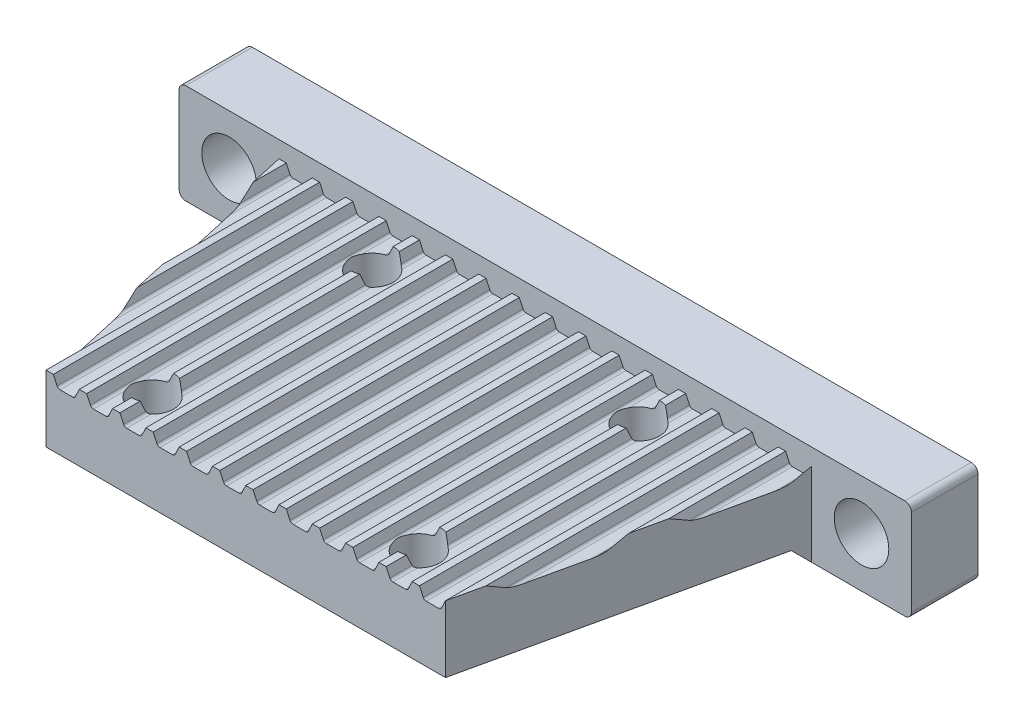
SolidWorks part; units mm, degrees
ref_plane "Plan de face" through (0, 0, 0) normal (0, 0, 1) x (1, 0, 0)
ref_plane "Plan de dessus" through (0, 0, 0) normal (0, 1, 0) x (1, 0, 0)
ref_plane "Plan de droite" through (0, 0, 0) normal (1, 0, 0) x (0, 0, -1)
sketch "Esquisse1" plane through (0, 0, 0) normal (0, 0, 1) x (1, 0, 0)
  line L1 (0, 0) -> (110, 0)
  line L2 (0, 0) -> (0, -15)
  line L3 (0, -15) -> (110, -15)
  line L4 (110, 0) -> (110, -15)
  dimension "D1" = 15
  dimension "D2" = 110
extrude "Boss.-Extru.1" add sketch "Esquisse1" along normal blind 10
sketch "Esquisse2" plane through (0, 0, 10) normal (0, 0, 1) x (1, 0, 0)
  line L1 (15, -2.5) -> (95, -2.5)
  line L2 (15, -2.5) -> (15, -12.5)
  line L3 (15, -12.5) -> (95, -12.5)
  line L4 (95, -2.5) -> (95, -12.5)
  line L5 (110, -15) -> (110, 0) construction
  line L6 (0, 0) -> (0, -15) construction
  point P8 (0, -7.5)
  point P9 (15, -7.5)
  dimension "D1" = 10
  dimension "D2" = 80
  dimension "D3" = 15
extrude "Boss.-Extru.2" add sketch "Esquisse2" along normal blind 45
sketch "Esquisse3" plane through (0, 0, 55) normal (0, 0, 1) x (1, 0, 0)
  line L0 (21.1011, -2.5) -> (20, -2.5) construction
  line L1 (16.1011, -2.5) -> (20, -2.5)
  line L6 (20, -2.5) -> (19.4352, -3.7113)
  line L7 (18.982, -4) -> (17.1191, -4)
  line L8 (16.6659, -3.7113) -> (16.1011, -2.5)
  line L9 (16.1011, -2.5) -> (15, -2.5) construction
  arc A0 (19.4352, -3.7113) -> (18.982, -4) centre (18.982, -3.5) cw
  arc A1 (17.1191, -4) -> (16.6659, -3.7113) centre (17.1191, -3.5) cw
  dimension "D5" = 0.5
  dimension "D6" = 0.5
  dimension "D1" = 1.8629
  dimension "D2" = 115
  dimension "D3" = 115
  dimension "D4" = 1.5
  dimension "D7" = 3.8989
  dimension "D8" = 1.1011
  dimension "D9" = 1.1011
extrude "Enlèv. mat.-Extru.1" cut sketch "Esquisse3" against normal blind 45
pattern_linear "Répétition linéaire1" count 19 spacing 5 along (1, 0, 0) of "Enlèv. mat.-Extru.1"
sketch "Esquisse5" plane through (0, -12.5, 0) normal (0, -1, 0) x (-1, 0, 0)
  line L0 (-85, -55) -> (-95, -10)
  line L2 (-95, -10) -> (-95, -55)
  line L3 (-95, -55) -> (-85, -55)
  line L4 (-15, -55) -> (-15, -10)
  line L5 (-15, -10) -> (-25, -55)
  line L6 (-25, -55) -> (-15, -55)
  dimension "D1" = 10
  dimension "D2" = 10
extrude "Enlèv. mat.-Extru.2" cut sketch "Esquisse5" against normal blind 45
sketch "Esquisse6" plane through (0, -12.5, 0) normal (0, -1, 0) x (1, 0, 0)
  line L1 (35, 16) -> (75, 16) construction
  line L2 (35, 16) -> (35, 49) construction
  line L3 (35, 49) -> (75, 49) construction
  line L4 (75, 16) -> (75, 49) construction
  line L6 (25, 55) -> (85, 55) construction
  circle A0 centre (35, 16) radius 3.15
  circle A1 centre (35, 49) radius 3.15
  circle A2 centre (75, 16) radius 3.15
  circle A3 centre (75, 49) radius 3.15
  point P7 (55, 49)
  point P18 (55, 55)
  dimension "D3" = 6.3
  dimension "D4" = 6
  dimension "D1" = 33
  dimension "D2" = 40
extrude "Enlèv. mat.-Extru.3" cut sketch "Esquisse6" against normal through all
chamfer "Chanfrein1" distance 2.5 angle 45 1 edges at (55, -12.5, 10)
sketch "Esquisse7" plane through (0, -12.5, 0) normal (0, -1, 0) x (1, 0, 0)
  circle A0 centre (35, 16) radius 5
  circle A1 centre (75, 16) radius 5
  dimension "D1" = 10
extrude "Enlèv. mat.-Extru.4" cut sketch "Esquisse7" along normal through all
sketch "Esquisse8" plane through (0, 0, 10) normal (0, 0, 1) x (1, 0, 0)
  line L0 (110, -15) -> (110, 0) construction
  line L2 (95, -15) -> (110, -15) construction
  line L3 (0, 0) -> (0, -15) construction
  circle A0 centre (7.5, -7.5) radius 4.1
  circle A1 centre (102.5, -7.5) radius 4.1
  dimension "D1" = 8.2
  dimension "D3" = 7.5
  dimension "D4" = 7.5
  dimension "D2" = 7.5
extrude "Enlèv. mat.-Extru.5" cut sketch "Esquisse8" against normal through all
fillet "Congé1" radius 1 4 edges at (110, -15, 5) (0, -15, 5) (0, 0, 5) (110, 0, 5)
